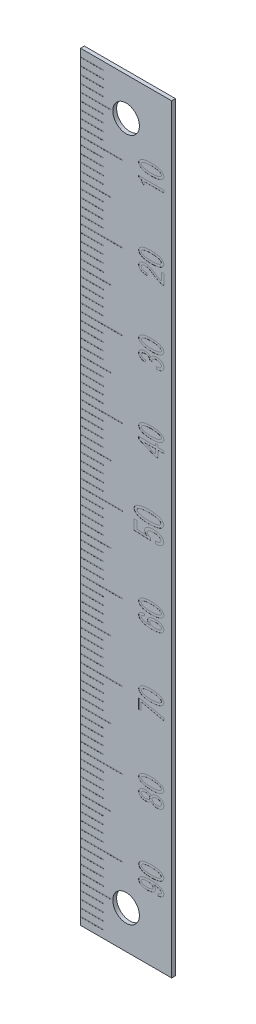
SolidWorks part; units mm, degrees
ref_plane "Front" through (0, 0, 0) normal (0, 0, 1) x (1, 0, 0)
ref_plane "Top" through (0, 0, 0) normal (0, 1, 0) x (1, 0, 0)
ref_plane "Right" through (0, 0, 0) normal (1, 0, 0) x (0, 0, -1)
sketch "Sketch1" plane through (0, 0, 0) normal (0, 0, 1) x (1, 0, 0)
  line L1 (0, 0) -> (0, 100)
  line L2 (0, 0) -> (12, 0)
  line L3 (12, 0) -> (12, 100)
  line L4 (0, 100) -> (12, 100)
  dimension "D1" = 100
  dimension "D2" = 12
extrude "Extrude1" add sketch "Sketch1" along normal blind 0.5
sketch "Sketch2" plane through (0, 0, 0.5) normal (0, 0, 1) x (1, 0, 0)
  line L0 (0, 100) -> (0, 0) construction
  line L1 (0, 0) -> (12, 0) construction
  line L2 (12, 100) -> (0, 100) construction
  circle A0 centre (6, 5) radius 1.75
  circle A1 centre (6, 95) radius 1.75
  dimension "D1" = 6
  dimension "D2" = 6
  dimension "D3" = 5
  dimension "D4" = 5
  dimension "D5" = 3.5
  dimension "D6" = 3.5
extrude "Extrude2" cut sketch "Sketch2" against normal through all
sketch "Sketch3" plane through (0, 0, 0.5) normal (0, 0, 1) x (1, 0, 0)
  line L0 (12, 100) -> (0, 100) construction
  line L1 (7.5, 88.25) -> (11, 88.25) construction
  line L2 (7.5, 88.25) -> (7.5, 91.75) construction
  line L3 (7.5, 91.75) -> (11, 91.75) construction
  line L4 (11, 88.25) -> (11, 91.75) construction
  line L6 (11, 78.25) -> (11, 81.75) construction
  line L7 (11, 68.25) -> (11, 71.75) construction
  line L8 (11, 58.25) -> (11, 61.75) construction
  line L9 (11, 48.25) -> (11, 51.75) construction
  line L10 (11, 38.25) -> (11, 41.75) construction
  line L11 (11, 28.25) -> (11, 31.75) construction
  line L12 (11, 18.25) -> (11, 21.75) construction
  line L13 (11, 8.25) -> (11, 11.75) construction
  line L15 (12, 0) -> (12, 100) construction
  line L16 (11, -1.75) -> (11, 1.75) construction
  text T0 "10" font "ＭＳ ゴシック" height in points 11
  text T1 "20" font "ＭＳ ゴシック" height in points 11
  text T2 "30" font "ＭＳ ゴシック" height in points 11
  text T3 "40" font "ＭＳ ゴシック" height in points 11
  text T4 "50" font "ＭＳ ゴシック" height in points 13
  text T5 "60  " font "ＭＳ ゴシック" height in points 11
  text T6 "70" font "ＭＳ ゴシック" height in points 11
  text T7 "80" font "ＭＳ ゴシック" height in points 11
  text T8 "90" font "ＭＳ ゴシック" height in points 11
  point P4 (11, 90)
  dimension "D1" = 3.5
  dimension "D2" = 10
  dimension "D3" = 1
  dimension "D4" = 3.5
  dimension "D5" = 4
  dimension "D6" = 7
extrude "Extrude3" cut sketch "Sketch3" against normal blind 0.01
sketch "Sketch4" plane through (0, 0, 0.5) normal (0, 0, 1) x (1, 0, 0)
  line L5 (12, 100) -> (0, 100) construction
  line L406 (6, 100) -> (6, 0) construction
  line L407 (0, 0) -> (12, 0) construction
  line L408 (3, 1.05) -> (3, 0.95)
  line L409 (0, 0.95) -> (3, 0.95)
  line L410 (0, 1.05) -> (3, 1.05)
  line L411 (0, 1.05) -> (0, 0.95)
  line L412 (3, 2.05) -> (3, 1.95)
  line L413 (0, 1.95) -> (3, 1.95)
  line L414 (0, 2.05) -> (3, 2.05)
  line L415 (0, 2.05) -> (0, 1.95)
  line L416 (3, 3.05) -> (3, 2.95)
  line L417 (0, 2.95) -> (3, 2.95)
  line L418 (0, 3.05) -> (3, 3.05)
  line L419 (0, 3.05) -> (0, 2.95)
  line L420 (3, 4.05) -> (3, 3.95)
  line L421 (0, 3.95) -> (3, 3.95)
  line L422 (0, 4.05) -> (3, 4.05)
  line L423 (0, 4.05) -> (0, 3.95)
  line L424 (3, 6.05) -> (3, 5.95)
  line L425 (0, 5.95) -> (3, 5.95)
  line L426 (0, 6.05) -> (3, 6.05)
  line L427 (0, 6.05) -> (0, 5.95)
  line L428 (3, 7.05) -> (3, 6.95)
  line L429 (0, 6.95) -> (3, 6.95)
  line L430 (0, 7.05) -> (3, 7.05)
  line L431 (0, 7.05) -> (0, 6.95)
  line L432 (3, 8.05) -> (3, 7.95)
  line L433 (0, 7.95) -> (3, 7.95)
  line L434 (0, 8.05) -> (3, 8.05)
  line L435 (3, 9.05) -> (3, 8.95)
  line L436 (0, 8.95) -> (3, 8.95)
  line L437 (0, 9.05) -> (0, 8.95)
  line L438 (0, 9.05) -> (3, 9.05)
  line L439 (4, 4.95) -> (4, 5.05)
  line L440 (0, 5.05) -> (4, 5.05)
  line L441 (0, 4.95) -> (0, 5.05)
  line L442 (0, 4.95) -> (4, 4.95)
  line L443 (0, 8.05) -> (0, 7.95)
  line L444 (0, 9.95) -> (0, 10.05)
  line L445 (5.5, 9.95) -> (0, 9.95)
  line L446 (5.5, 10.05) -> (5.5, 9.95)
  line L447 (0, 10.05) -> (5.5, 10.05)
  line L448 (3, 11.05) -> (3, 10.95)
  line L449 (0, 10.95) -> (3, 10.95)
  line L450 (0, 11.05) -> (3, 11.05)
  line L451 (0, 11.05) -> (0, 10.95)
  line L452 (3, 12.05) -> (3, 11.95)
  line L453 (0, 11.95) -> (3, 11.95)
  line L454 (0, 12.05) -> (3, 12.05)
  line L455 (0, 12.05) -> (0, 11.95)
  line L456 (3, 13.05) -> (3, 12.95)
  line L457 (0, 12.95) -> (3, 12.95)
  line L458 (0, 13.05) -> (3, 13.05)
  line L459 (0, 13.05) -> (0, 12.95)
  line L460 (3, 14.05) -> (3, 13.95)
  line L461 (0, 13.95) -> (3, 13.95)
  line L462 (0, 14.05) -> (3, 14.05)
  line L463 (0, 14.05) -> (0, 13.95)
  line L464 (3, 16.05) -> (3, 15.95)
  line L465 (0, 15.95) -> (3, 15.95)
  line L466 (0, 16.05) -> (3, 16.05)
  line L467 (0, 16.05) -> (0, 15.95)
  line L468 (3, 17.05) -> (3, 16.95)
  line L469 (0, 16.95) -> (3, 16.95)
  line L470 (0, 17.05) -> (3, 17.05)
  line L471 (0, 17.05) -> (0, 16.95)
  line L472 (3, 18.05) -> (3, 17.95)
  line L473 (0, 17.95) -> (3, 17.95)
  line L474 (0, 18.05) -> (3, 18.05)
  line L475 (3, 19.05) -> (3, 18.95)
  line L476 (0, 18.95) -> (3, 18.95)
  line L477 (0, 19.05) -> (0, 18.95)
  line L478 (0, 19.05) -> (3, 19.05)
  line L479 (4, 14.95) -> (4, 15.05)
  line L480 (0, 15.05) -> (4, 15.05)
  line L481 (0, 14.95) -> (0, 15.05)
  line L482 (0, 14.95) -> (4, 14.95)
  line L483 (0, 18.05) -> (0, 17.95)
  line L484 (0, 19.95) -> (0, 20.05)
  line L485 (5.5, 19.95) -> (0, 19.95)
  line L486 (5.5, 20.05) -> (5.5, 19.95)
  line L487 (0, 20.05) -> (5.5, 20.05)
  line L488 (3, 21.05) -> (3, 20.95)
  line L489 (0, 20.95) -> (3, 20.95)
  line L490 (0, 21.05) -> (3, 21.05)
  line L491 (0, 21.05) -> (0, 20.95)
  line L492 (3, 22.05) -> (3, 21.95)
  line L493 (0, 21.95) -> (3, 21.95)
  line L494 (0, 22.05) -> (3, 22.05)
  line L495 (0, 22.05) -> (0, 21.95)
  line L496 (3, 23.05) -> (3, 22.95)
  line L497 (0, 22.95) -> (3, 22.95)
  line L498 (0, 23.05) -> (3, 23.05)
  line L499 (0, 23.05) -> (0, 22.95)
  line L500 (3, 24.05) -> (3, 23.95)
  line L501 (0, 23.95) -> (3, 23.95)
  line L502 (0, 24.05) -> (3, 24.05)
  line L503 (0, 24.05) -> (0, 23.95)
  line L504 (3, 26.05) -> (3, 25.95)
  line L505 (0, 25.95) -> (3, 25.95)
  line L506 (0, 26.05) -> (3, 26.05)
  line L507 (0, 26.05) -> (0, 25.95)
  line L508 (3, 27.05) -> (3, 26.95)
  line L509 (0, 26.95) -> (3, 26.95)
  line L510 (0, 27.05) -> (3, 27.05)
  line L511 (0, 27.05) -> (0, 26.95)
  line L512 (3, 28.05) -> (3, 27.95)
  line L513 (0, 27.95) -> (3, 27.95)
  line L514 (0, 28.05) -> (3, 28.05)
  line L515 (3, 29.05) -> (3, 28.95)
  line L516 (0, 28.95) -> (3, 28.95)
  line L517 (0, 29.05) -> (0, 28.95)
  line L518 (0, 29.05) -> (3, 29.05)
  line L519 (4, 24.95) -> (4, 25.05)
  line L520 (0, 25.05) -> (4, 25.05)
  line L521 (0, 24.95) -> (0, 25.05)
  line L522 (0, 24.95) -> (4, 24.95)
  line L523 (0, 28.05) -> (0, 27.95)
  line L524 (0, 29.95) -> (0, 30.05)
  line L525 (5.5, 29.95) -> (0, 29.95)
  line L526 (5.5, 30.05) -> (5.5, 29.95)
  line L527 (0, 30.05) -> (5.5, 30.05)
  line L528 (3, 31.05) -> (3, 30.95)
  line L529 (0, 30.95) -> (3, 30.95)
  line L530 (0, 31.05) -> (3, 31.05)
  line L531 (0, 31.05) -> (0, 30.95)
  line L532 (3, 32.05) -> (3, 31.95)
  line L533 (0, 31.95) -> (3, 31.95)
  line L534 (0, 32.05) -> (3, 32.05)
  line L535 (0, 32.05) -> (0, 31.95)
  line L536 (3, 33.05) -> (3, 32.95)
  line L537 (0, 32.95) -> (3, 32.95)
  line L538 (0, 33.05) -> (3, 33.05)
  line L539 (0, 33.05) -> (0, 32.95)
  line L540 (3, 34.05) -> (3, 33.95)
  line L541 (0, 33.95) -> (3, 33.95)
  line L542 (0, 34.05) -> (3, 34.05)
  line L543 (0, 34.05) -> (0, 33.95)
  line L544 (3, 36.05) -> (3, 35.95)
  line L545 (0, 35.95) -> (3, 35.95)
  line L546 (0, 36.05) -> (3, 36.05)
  line L547 (0, 36.05) -> (0, 35.95)
  line L548 (3, 37.05) -> (3, 36.95)
  line L549 (0, 36.95) -> (3, 36.95)
  line L550 (0, 37.05) -> (3, 37.05)
  line L551 (0, 37.05) -> (0, 36.95)
  line L552 (3, 38.05) -> (3, 37.95)
  line L553 (0, 37.95) -> (3, 37.95)
  line L554 (0, 38.05) -> (3, 38.05)
  line L555 (3, 39.05) -> (3, 38.95)
  line L556 (0, 38.95) -> (3, 38.95)
  line L557 (0, 39.05) -> (0, 38.95)
  line L558 (0, 39.05) -> (3, 39.05)
  line L559 (4, 34.95) -> (4, 35.05)
  line L560 (0, 35.05) -> (4, 35.05)
  line L561 (0, 34.95) -> (0, 35.05)
  line L562 (0, 34.95) -> (4, 34.95)
  line L563 (0, 38.05) -> (0, 37.95)
  line L564 (0, 39.95) -> (0, 40.05)
  line L565 (5.5, 39.95) -> (0, 39.95)
  line L566 (5.5, 40.05) -> (5.5, 39.95)
  line L567 (0, 40.05) -> (5.5, 40.05)
  line L568 (3, 41.05) -> (3, 40.95)
  line L569 (0, 40.95) -> (3, 40.95)
  line L570 (0, 41.05) -> (3, 41.05)
  line L571 (0, 41.05) -> (0, 40.95)
  line L572 (3, 42.05) -> (3, 41.95)
  line L573 (0, 41.95) -> (3, 41.95)
  line L574 (0, 42.05) -> (3, 42.05)
  line L575 (0, 42.05) -> (0, 41.95)
  line L576 (3, 43.05) -> (3, 42.95)
  line L577 (0, 42.95) -> (3, 42.95)
  line L578 (0, 43.05) -> (3, 43.05)
  line L579 (0, 43.05) -> (0, 42.95)
  line L580 (3, 44.05) -> (3, 43.95)
  line L581 (0, 43.95) -> (3, 43.95)
  line L582 (0, 44.05) -> (3, 44.05)
  line L583 (0, 44.05) -> (0, 43.95)
  line L584 (3, 46.05) -> (3, 45.95)
  line L585 (0, 45.95) -> (3, 45.95)
  line L586 (0, 46.05) -> (3, 46.05)
  line L587 (0, 46.05) -> (0, 45.95)
  line L588 (3, 47.05) -> (3, 46.95)
  line L589 (0, 46.95) -> (3, 46.95)
  line L590 (0, 47.05) -> (3, 47.05)
  line L591 (0, 47.05) -> (0, 46.95)
  line L592 (3, 48.05) -> (3, 47.95)
  line L593 (0, 47.95) -> (3, 47.95)
  line L594 (0, 48.05) -> (3, 48.05)
  line L595 (3, 49.05) -> (3, 48.95)
  line L596 (0, 48.95) -> (3, 48.95)
  line L597 (0, 49.05) -> (0, 48.95)
  line L598 (0, 49.05) -> (3, 49.05)
  line L599 (4, 44.95) -> (4, 45.05)
  line L600 (0, 45.05) -> (4, 45.05)
  line L601 (0, 44.95) -> (0, 45.05)
  line L602 (0, 44.95) -> (4, 44.95)
  line L603 (0, 48.05) -> (0, 47.95)
  line L604 (3, 51.05) -> (3, 50.95)
  line L605 (0, 50.95) -> (3, 50.95)
  line L606 (0, 51.05) -> (3, 51.05)
  line L607 (0, 51.05) -> (0, 50.95)
  line L608 (3, 52.05) -> (3, 51.95)
  line L609 (0, 51.95) -> (3, 51.95)
  line L610 (0, 52.05) -> (3, 52.05)
  line L611 (0, 52.05) -> (0, 51.95)
  line L612 (3, 53.05) -> (3, 52.95)
  line L613 (0, 52.95) -> (3, 52.95)
  line L614 (0, 53.05) -> (3, 53.05)
  line L615 (0, 53.05) -> (0, 52.95)
  line L616 (3, 54.05) -> (3, 53.95)
  line L617 (0, 53.95) -> (3, 53.95)
  line L618 (0, 54.05) -> (3, 54.05)
  line L619 (0, 54.05) -> (0, 53.95)
  line L620 (3, 56.05) -> (3, 55.95)
  line L621 (0, 55.95) -> (3, 55.95)
  line L622 (0, 56.05) -> (3, 56.05)
  line L623 (0, 56.05) -> (0, 55.95)
  line L624 (3, 57.05) -> (3, 56.95)
  line L625 (0, 56.95) -> (3, 56.95)
  line L626 (0, 57.05) -> (3, 57.05)
  line L627 (0, 57.05) -> (0, 56.95)
  line L628 (3, 58.05) -> (3, 57.95)
  line L629 (0, 57.95) -> (3, 57.95)
  line L630 (0, 58.05) -> (3, 58.05)
  line L631 (3, 59.05) -> (3, 58.95)
  line L632 (0, 58.95) -> (3, 58.95)
  line L633 (0, 59.05) -> (0, 58.95)
  line L634 (0, 59.05) -> (3, 59.05)
  line L635 (4, 54.95) -> (4, 55.05)
  line L636 (0, 55.05) -> (4, 55.05)
  line L637 (0, 54.95) -> (0, 55.05)
  line L638 (0, 54.95) -> (4, 54.95)
  line L639 (0, 58.05) -> (0, 57.95)
  line L640 (0, 49.95) -> (0, 50.05)
  line L641 (5.5, 49.95) -> (0, 49.95)
  line L642 (5.5, 50.05) -> (5.5, 49.95)
  line L643 (0, 50.05) -> (5.5, 50.05)
  line L644 (3, 61.05) -> (3, 60.95)
  line L645 (0, 60.95) -> (3, 60.95)
  line L646 (0, 61.05) -> (3, 61.05)
  line L647 (0, 61.05) -> (0, 60.95)
  line L648 (3, 62.05) -> (3, 61.95)
  line L649 (0, 61.95) -> (3, 61.95)
  line L650 (0, 62.05) -> (3, 62.05)
  line L651 (0, 62.05) -> (0, 61.95)
  line L652 (3, 63.05) -> (3, 62.95)
  line L653 (0, 62.95) -> (3, 62.95)
  line L654 (0, 63.05) -> (3, 63.05)
  line L655 (0, 63.05) -> (0, 62.95)
  line L656 (3, 64.05) -> (3, 63.95)
  line L657 (0, 63.95) -> (3, 63.95)
  line L658 (0, 64.05) -> (3, 64.05)
  line L659 (0, 64.05) -> (0, 63.95)
  line L660 (3, 66.05) -> (3, 65.95)
  line L661 (0, 65.95) -> (3, 65.95)
  line L662 (0, 66.05) -> (3, 66.05)
  line L663 (0, 66.05) -> (0, 65.95)
  line L664 (3, 67.05) -> (3, 66.95)
  line L665 (0, 66.95) -> (3, 66.95)
  line L666 (0, 67.05) -> (3, 67.05)
  line L667 (0, 67.05) -> (0, 66.95)
  line L668 (3, 68.05) -> (3, 67.95)
  line L669 (0, 67.95) -> (3, 67.95)
  line L670 (0, 68.05) -> (3, 68.05)
  line L671 (3, 69.05) -> (3, 68.95)
  line L672 (0, 68.95) -> (3, 68.95)
  line L673 (0, 69.05) -> (0, 68.95)
  line L674 (0, 69.05) -> (3, 69.05)
  line L675 (4, 64.95) -> (4, 65.05)
  line L676 (0, 65.05) -> (4, 65.05)
  line L677 (0, 64.95) -> (0, 65.05)
  line L678 (0, 64.95) -> (4, 64.95)
  line L679 (0, 68.05) -> (0, 67.95)
  line L680 (0, 59.95) -> (0, 60.05)
  line L681 (5.5, 59.95) -> (0, 59.95)
  line L682 (5.5, 60.05) -> (5.5, 59.95)
  line L683 (0, 60.05) -> (5.5, 60.05)
  line L684 (3, 71.05) -> (3, 70.95)
  line L685 (0, 70.95) -> (3, 70.95)
  line L686 (0, 71.05) -> (3, 71.05)
  line L687 (0, 71.05) -> (0, 70.95)
  line L688 (3, 72.05) -> (3, 71.95)
  line L689 (0, 71.95) -> (3, 71.95)
  line L690 (0, 72.05) -> (3, 72.05)
  line L691 (0, 72.05) -> (0, 71.95)
  line L692 (3, 73.05) -> (3, 72.95)
  line L693 (0, 72.95) -> (3, 72.95)
  line L694 (0, 73.05) -> (3, 73.05)
  line L695 (0, 73.05) -> (0, 72.95)
  line L696 (3, 74.05) -> (3, 73.95)
  line L697 (0, 73.95) -> (3, 73.95)
  line L698 (0, 74.05) -> (3, 74.05)
  line L699 (0, 74.05) -> (0, 73.95)
  line L700 (3, 76.05) -> (3, 75.95)
  line L701 (0, 75.95) -> (3, 75.95)
  line L702 (0, 76.05) -> (3, 76.05)
  line L703 (0, 76.05) -> (0, 75.95)
  line L704 (3, 77.05) -> (3, 76.95)
  line L705 (0, 76.95) -> (3, 76.95)
  line L706 (0, 77.05) -> (3, 77.05)
  line L707 (0, 77.05) -> (0, 76.95)
  line L708 (3, 78.05) -> (3, 77.95)
  line L709 (0, 77.95) -> (3, 77.95)
  line L710 (0, 78.05) -> (3, 78.05)
  line L711 (3, 79.05) -> (3, 78.95)
  line L712 (0, 78.95) -> (3, 78.95)
  line L713 (0, 79.05) -> (0, 78.95)
  line L714 (0, 79.05) -> (3, 79.05)
  line L715 (4, 74.95) -> (4, 75.05)
  line L716 (0, 75.05) -> (4, 75.05)
  line L717 (0, 74.95) -> (0, 75.05)
  line L718 (0, 74.95) -> (4, 74.95)
  line L719 (0, 78.05) -> (0, 77.95)
  line L720 (0, 69.95) -> (0, 70.05)
  line L721 (5.5, 69.95) -> (0, 69.95)
  line L722 (5.5, 70.05) -> (5.5, 69.95)
  line L723 (0, 70.05) -> (5.5, 70.05)
  line L724 (3, 81.05) -> (3, 80.95)
  line L725 (0, 80.95) -> (3, 80.95)
  line L726 (0, 81.05) -> (3, 81.05)
  line L727 (0, 81.05) -> (0, 80.95)
  line L728 (3, 82.05) -> (3, 81.95)
  line L729 (0, 81.95) -> (3, 81.95)
  line L730 (0, 82.05) -> (3, 82.05)
  line L731 (0, 82.05) -> (0, 81.95)
  line L732 (3, 83.05) -> (3, 82.95)
  line L733 (0, 82.95) -> (3, 82.95)
  line L734 (0, 83.05) -> (3, 83.05)
  line L735 (0, 83.05) -> (0, 82.95)
  line L736 (3, 84.05) -> (3, 83.95)
  line L737 (0, 83.95) -> (3, 83.95)
  line L738 (0, 84.05) -> (3, 84.05)
  line L739 (0, 84.05) -> (0, 83.95)
  line L740 (3, 86.05) -> (3, 85.95)
  line L741 (0, 85.95) -> (3, 85.95)
  line L742 (0, 86.05) -> (3, 86.05)
  line L743 (0, 86.05) -> (0, 85.95)
  line L744 (3, 87.05) -> (3, 86.95)
  line L745 (0, 86.95) -> (3, 86.95)
  line L746 (0, 87.05) -> (3, 87.05)
  line L747 (0, 87.05) -> (0, 86.95)
  line L748 (3, 88.05) -> (3, 87.95)
  line L749 (0, 87.95) -> (3, 87.95)
  line L750 (0, 88.05) -> (3, 88.05)
  line L751 (3, 89.05) -> (3, 88.95)
  line L752 (0, 88.95) -> (3, 88.95)
  line L753 (0, 89.05) -> (0, 88.95)
  line L754 (0, 89.05) -> (3, 89.05)
  line L755 (4, 84.95) -> (4, 85.05)
  line L756 (0, 85.05) -> (4, 85.05)
  line L757 (0, 84.95) -> (0, 85.05)
  line L758 (0, 84.95) -> (4, 84.95)
  line L759 (0, 88.05) -> (0, 87.95)
  line L760 (3, 91.05) -> (3, 90.95)
  line L761 (0, 90.95) -> (3, 90.95)
  line L762 (0, 91.05) -> (3, 91.05)
  line L763 (0, 91.05) -> (0, 90.95)
  line L764 (3, 92.05) -> (3, 91.95)
  line L765 (0, 91.95) -> (3, 91.95)
  line L766 (0, 92.05) -> (3, 92.05)
  line L767 (0, 92.05) -> (0, 91.95)
  line L768 (3, 93.05) -> (3, 92.95)
  line L769 (0, 92.95) -> (3, 92.95)
  line L770 (0, 93.05) -> (3, 93.05)
  line L771 (0, 93.05) -> (0, 92.95)
  line L772 (3, 94.05) -> (3, 93.95)
  line L773 (0, 93.95) -> (3, 93.95)
  line L774 (0, 94.05) -> (3, 94.05)
  line L775 (0, 94.05) -> (0, 93.95)
  line L776 (0, 79.95) -> (0, 80.05)
  line L777 (5.5, 79.95) -> (0, 79.95)
  line L778 (5.5, 80.05) -> (5.5, 79.95)
  line L779 (0, 80.05) -> (5.5, 80.05)
  line L780 (3, 96.05) -> (3, 95.95)
  line L781 (0, 95.95) -> (3, 95.95)
  line L782 (0, 96.05) -> (3, 96.05)
  line L783 (0, 96.05) -> (0, 95.95)
  line L784 (3, 97.05) -> (3, 96.95)
  line L785 (0, 96.95) -> (3, 96.95)
  line L786 (0, 97.05) -> (3, 97.05)
  line L787 (0, 97.05) -> (0, 96.95)
  line L788 (3, 98.05) -> (3, 97.95)
  line L789 (0, 97.95) -> (3, 97.95)
  line L790 (0, 98.05) -> (3, 98.05)
  line L791 (3, 99.05) -> (3, 98.95)
  line L792 (0, 98.95) -> (3, 98.95)
  line L793 (0, 99.05) -> (0, 98.95)
  line L794 (0, 99.05) -> (3, 99.05)
  line L795 (4, 94.95) -> (4, 95.05)
  line L796 (0, 95.05) -> (4, 95.05)
  line L797 (0, 94.95) -> (0, 95.05)
  line L798 (0, 94.95) -> (4, 94.95)
  line L799 (0, 98.05) -> (0, 97.95)
  line L800 (0, 89.95) -> (0, 90.05)
  line L801 (5.5, 89.95) -> (0, 89.95)
  line L802 (5.5, 90.05) -> (5.5, 89.95)
  line L803 (0, 90.05) -> (5.5, 90.05)
extrude "Extrude4" cut sketch "Sketch4" against normal blind 0.01
move or copy body "Body-Move/Copy2" bodies to move or copy 105 copy no translate (-12, -50, 0)
move or copy body "Body-Move/Copy3" bodies to move or copy 107 copy no translate (0, -50, 0)
